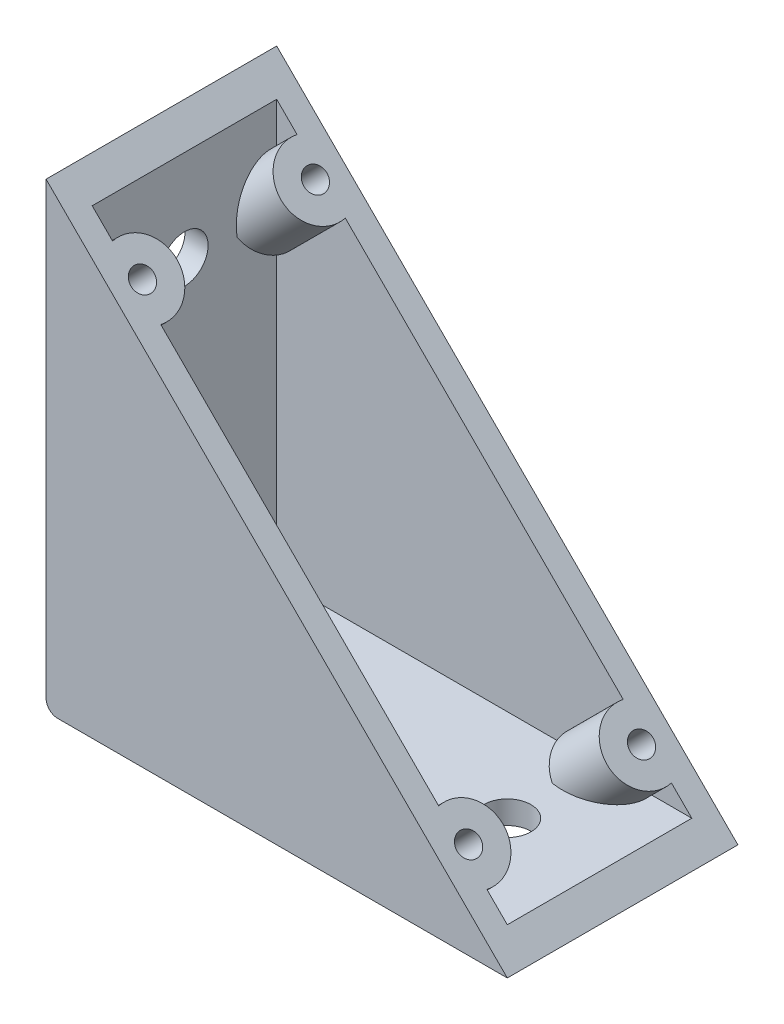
SolidWorks part; units mm, degrees
ref_plane "Alzado" through (0, 0, 0) normal (0, 0, 1) x (1, 0, 0)
ref_plane "Planta" through (0, 0, 0) normal (0, 1, 0) x (1, 0, 0)
ref_plane "Vista lateral" through (0, 0, 0) normal (1, 0, 0) x (0, 0, -1)
sketch "Croquis1" plane through (0, 0, 0) normal (0, 0, 1) x (1, 0, 0)
  line L0 (0, 0) -> (80, 0)
  line L1 (0, 0) -> (0, 80)
  line L2 (0, 80) -> (80, 0)
extrude "Extruir1" add sketch "Croquis1" along normal blind 40
sketch "Croquis2" plane through (40, 40, 0) normal (0.7071, 0.7071, 0) x (0, 0, -1)
  point P0 (-5, 40)
  point P1 (-35, 40)
  point P2 (-35, -40)
  point P3 (-5, -40)
hole_wizard "Diámetro de taladro Ø4.0 (4)1" positions "Croquis3D1" profile "Croquis3" hole size "Ø4.0" standard "ISO"
sketch3d "Croquis3D1"
  point P0 (11.7157, 68.2843, 35)
  point P3 (11.7157, 68.2843, 5)
  point P6 (68.2843, 11.7157, 35)
  point P9 (68.2843, 11.7157, 5)
  point P12 (0, 80.2463, 61.6831)
sketch "Croquis3" plane through (11.7157, 68.2843, 35) normal (0, 0, 1) x (-0.7071, 0.7071, 0)
  line L0 (0, 0) -> (0, 11.2017)
  line L1 (0, 11.2017) -> (2, 10)
  line L2 (2, 10) -> (2, 0)
  line L5 (2, 0) -> (0, 0)
  line L10 (0, 11.2017) -> (-2, 10) construction
  line L11 (0, -6.35) -> (0, 107.95) construction
  dimension "Diámetro de taladro" = 4
  dimension "Profundidad de taladro" = 10
  dimension "Ángulo de perforador" = 118
shell "Vaciado1" thickness 4
sketch "Croquis4" plane through (0, 0, 0) normal (-1, 0, 0) x (0, 0, 1)
  point P0 (20, 20)
  point P1 (20, 60)
hole_wizard "Taladro de diámetro de Ø8.2 (8.2)1" positions "Croquis3D2" profile "Croquis5" hole size "Ø8.2" standard "ISO"
sketch3d "Croquis3D2"
  point P0 (0, 20, 20)
  point P3 (0, 60, 20)
sketch "Croquis5" plane through (0, 20, 20) normal (0, 1, 0) x (0, 0, 1)
  line L0 (0, 0) -> (0, 80)
  line L1 (0, 80) -> (4.1, 80)
  line L2 (4.1, 80) -> (4.1, 0)
  line L5 (4.1, 0) -> (0, 0)
  line L11 (0, -6.35) -> (0, 107.95) construction
  dimension "Diámetro de taladro hasta el siguiente" = 8.2
  dimension "Profundidad de taladro hasta el siguiente" = 80
sketch "Croquis6" plane through (0, 0, 0) normal (0, -1, 0) x (1, 0, 0)
  point P0 (20, 20)
  point P1 (60, 20)
hole_wizard "Taladro de diámetro de Ø8.2 (8.2)2" positions "Croquis3D3" profile "Croquis8" hole size "Ø8.2" standard "ISO"
sketch3d "Croquis3D3"
  point P0 (20, 0, 20)
  point P3 (60, 0, 20)
sketch "Croquis8" plane through (20, 0, 20) normal (1, 0, 0) x (0, 0, -1)
  line L0 (0, 0) -> (0, 80)
  line L1 (0, 80) -> (4.1, 80)
  line L2 (4.1, 80) -> (4.1, 0)
  line L5 (4.1, 0) -> (0, 0)
  line L11 (0, -6.35) -> (0, 107.95) construction
  dimension "Diámetro de taladro hasta el siguiente" = 8.2
  dimension "Profundidad de taladro hasta el siguiente" = 80
sketch "Croquis9" plane through (0, 0, 0) normal (-1, 0, 0) x (0, 0, 1)
  line L0 (16, 38) -> (24, 38)
  line L1 (16, 40) -> (24, 40)
  line L2 (16, 38) -> (16, 40)
  line L3 (24, 40) -> (24, 38)
  line L4 (16, 73) -> (24, 73)
  line L5 (24, 73) -> (24, 71)
  line L6 (24, 71) -> (16, 71)
  line L7 (16, 71) -> (16, 73)
extrude "Extruir2" add sketch "Croquis9" along normal blind 3
sketch "Croquis10" plane through (0, 0, 0) normal (0, -1, 0) x (1, 0, 0)
  line L0 (71, 24) -> (71, 16)
  line L1 (71, 16) -> (73, 16)
  line L2 (73, 16) -> (73, 24)
  line L3 (73, 24) -> (71, 24)
  line L4 (40, 24) -> (40, 16)
  line L5 (40, 16) -> (38, 16)
  line L6 (38, 16) -> (38, 24)
  line L7 (40, 24) -> (38, 24)
  point P6 (0, 0)
extrude "Extruir3" add sketch "Croquis10" along normal blind 3
fillet "Redondeo2" radius 2 1 edges at (0, 0, 20)
